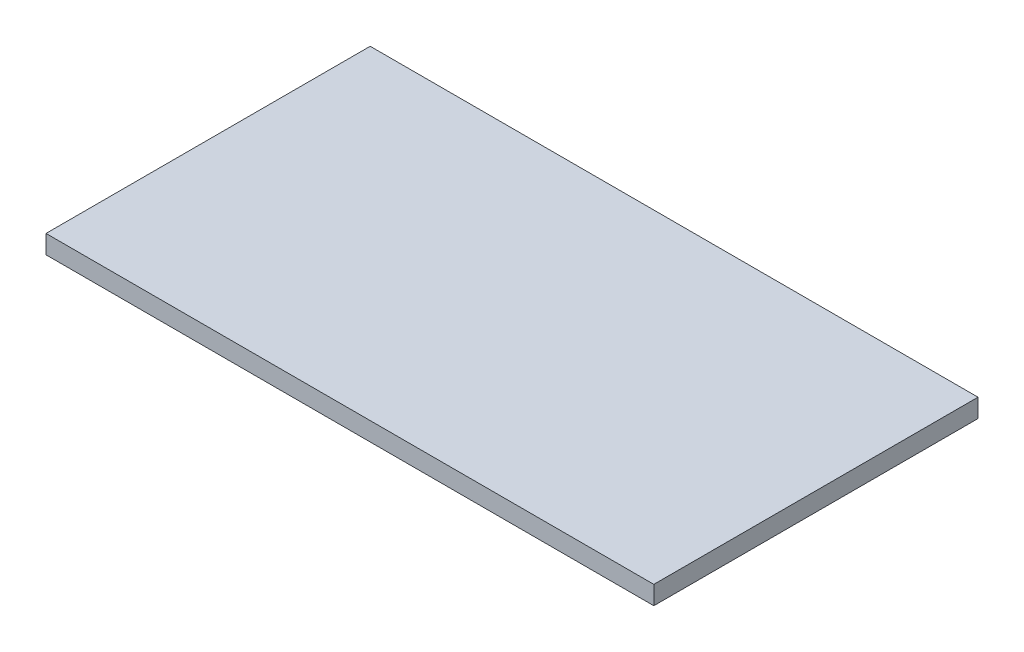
SolidWorks part; units mm, degrees
ref_plane "Front Plane" through (0, 0, 0) normal (0, 0, 1) x (1, 0, 0)
ref_plane "Top Plane" through (0, 0, 0) normal (0, 1, 0) x (1, 0, 0)
ref_plane "Right Plane" through (0, 0, 0) normal (1, 0, 0) x (0, 0, -1)
sketch "Sketch1" plane through (0, 0, 0) normal (0, 0, 1) x (1, 0, 0)
  line L6 (-300, 349.4636) -> (300, 349.4636)
  line L7 (300, 349.4636) -> (300, 331.1673)
  line L9 (300, 331.1673) -> (-300, 331.1673)
  line L10 (-300, 349.4636) -> (-300, 331.1673)
extrude "Boss-Extrude1" add sketch "Sketch1" along normal blind 320 from offset 25
